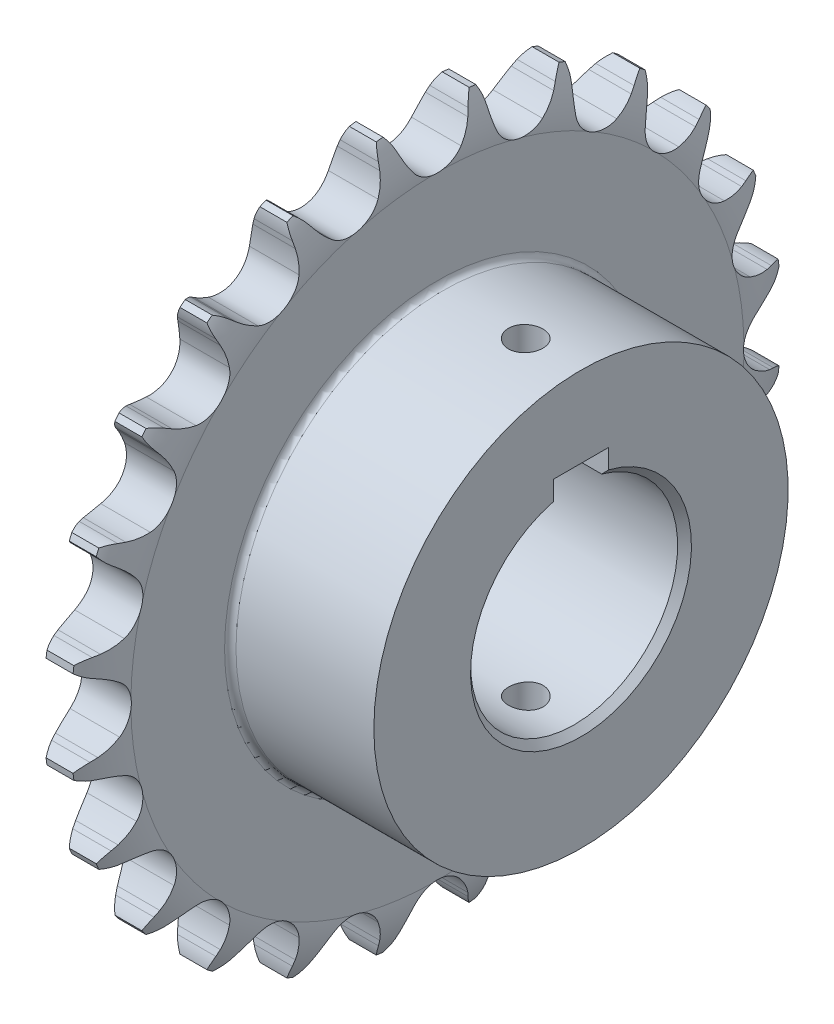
SolidWorks part; units mm, degrees
ref_plane "前视基准面" through (0, 0, 0) normal (0, 0, 1) x (1, 0, 0)
ref_plane "上视基准面" through (0, 0, 0) normal (0, 1, 0) x (1, 0, 0)
ref_plane "右视基准面" through (0, 0, 0) normal (1, 0, 0) x (0, 0, -1)
sketch "草图1" plane through (0, 0, 0) normal (0, 0, 1) x (1, 0, 0)
  line L0 (-6.35, 0) -> (6.35, 0) construction
  line L3 (-3.6038, 15) -> (-3.6037, 44.3942)
  line L4 (-1.9527, 51.5) -> (1.9527, 51.5)
  line L5 (3.6037, 44.3942) -> (3.6038, 30.8279)
  line L6 (4.4317, 30) -> (24.3963, 30)
  line L7 (24.3963, 30) -> (24.3963, 15)
  line L8 (24.3963, 15) -> (-3.6038, 15)
  line L9 (0, 0) -> (0, 51.5) construction
  line L10 (-3.1499, 48.6492) -> (3.1499, 48.6492) construction
  line L11 (-3.1499, -48.6492) -> (3.1499, -48.6492) construction
  line L12 (6.35, 0) -> (30.35, 0) construction
  line L13 (-3.6037, 44.3942) -> (3.7984, 44.3942) construction
  line L14 (-3.6037, -44.3942) -> (3.7984, -44.3942) construction
  line L15 (30.35, 0) -> (38.86, 0) construction
  line L16 (38.86, 0) -> (50.67, 0) construction
  line L17 (50.67, 0) -> (58.42, 0) construction
  line L18 (58.42, 0) -> (72.34, 0) construction
  arc A0 (-1.9527, 51.5) -> (-3.6037, 44.3942) centre (9.071, 45.194) ccw
  arc A1 (1.9527, 51.5) -> (3.6037, 44.3942) centre (-9.071, 45.194) cw
  arc A2 (3.6038, 30.8279) -> (4.4317, 30) centre (4.4317, 30.8279) ccw
  point P30 (3.6038, 30)
  dimension "D1" = 28
  dimension "rx" = 12.7
  dimension "D3" = 0.8279
  dimension "d" = 97.2985
  dimension "p" = 12.7
  dimension "z" = 24
  dimension "da" = 103
  dimension "df" = 88.7885
  dimension "dr" = 8.51
  dimension "dk" = 30
  dimension "h" = 11.81
  dimension "bf1" = 7.2075
  dimension "b1" = 7.75
  dimension "ba" = 1.651
  dimension "D2" = 30
  dimension "pt" = 13.92
revolve "旋转1" add sketch "草图1" angle 360 about L0
sketch "草图2" plane through (0, 0, 0) normal (1, 0, 0) x (0, 0, -1)
  line L0 (0, 0) -> (0, 51.5) construction
  line L1 (0, 0) -> (-6.7221, 51.0594) construction
  line L2 (0, 0) -> (-13.3292, 49.7452) construction
  line L3 (3.4323, 46.0156) -> (7.9862, 42.5212) construction
  line L4 (4.9345, 48.6528) -> (-5.4011, 52.7937) construction
  line L5 (0, 0) -> (6.7221, 51.0594) construction
  line L6 (4.9345, 48.6528) -> (5.2693, 49.4885)
  line L7 (-4.9345, 48.6528) -> (-5.2693, 49.4885)
  circle A0 centre (0, 0) radius 51.5 construction
  arc A1 (3.4323, 46.0156) -> (-3.4323, 46.0156) centre (0, 48.6492) cw
  arc A2 (3.4323, 46.0156) -> (4.9345, 48.6528) centre (-5.4011, 52.7937) ccw
  arc A3 (6.2395, 51.1206) -> (5.2693, 49.4885) centre (10.9684, 47.2052) ccw
  arc A4 (-3.4323, 46.0156) -> (-4.9345, 48.6528) centre (5.4011, 52.7937) cw
  arc A5 (-6.2395, 51.1206) -> (-5.2693, 49.4885) centre (-10.9684, 47.2052) cw
  arc A7 (6.2395, 51.1206) -> (-6.2395, 51.1206) centre (0, 0) ccw
  dimension "r1" = 4.3263
  dimension "r3" = 6.1394
  dimension "D1" = 15
  dimension "D2" = 7.5
  dimension "α/2" = 52.5
  dimension "M" = 5.4011
  dimension "T" = 4.1444
  dimension "β" = 15.667
  dimension "γ/2" = 14.333
  dimension "bc" = 0.9004
extrude "切除-拉伸1" cut sketch "草图2" against normal mid plane 9.2773
pattern_circular "阵列(圆周)1" count 24 over 360 about axis through (0, 0, 0) along (1, 0, 0) of "切除-拉伸1"
chamfer "倒角2" distance 1 angle 45 2 edges at (24.3963, 0, 15) (-3.6038, 0, 15)
sketch "草图3" plane through (-3.6038, 0, 0) normal (-1, 0, 0) x (0, 0, 1)
  line L1 (-4, 18.3) -> (4, 18.3)
  line L2 (-4, 18.3) -> (-4, 3.7919)
  line L3 (-4, 3.7919) -> (4, 3.7919)
  line L4 (4, 18.3) -> (4, 3.7919)
  dimension "D1" = 8
  dimension "D2" = 4
  dimension "D3" = 18.3
extrude "切除-拉伸2" cut sketch "草图3" against normal through all
ref_plane "基准面1" through (0, 30, 0) normal (0, 1, 0) x (1, 0, 0)
hole_wizard "M6 螺纹孔1" positions "草图5" profile "草图4" tap size "M6" standard "GB"
sketch "草图5" plane through (0, 30, 0) normal (0, 1, 0) x (1, 0, 0)
  line L0 (24.3963, -30) -> (24.3963, 30) construction
  line L1 (0, 0) -> (29.3982, 0) construction
  point P0 (16.3963, 0)
  dimension "D1" = 8
sketch "草图4" plane through (16.3963, 30, 0) normal (1, 0, 0) x (0, 0, 1)
  line L0 (0, 0) -> (0, 81.1206)
  line L1 (0, 81.1206) -> (2.5, 81.1206)
  line L2 (2.5, 81.1206) -> (2.5, 0)
  line L5 (2.5, 0) -> (0, 0)
  line L11 (0, -6.35) -> (0, 107.95) construction
  dimension "通孔螺纹孔钻头直径" = 5
  dimension "通孔螺纹孔钻头深度" = 81.1206
